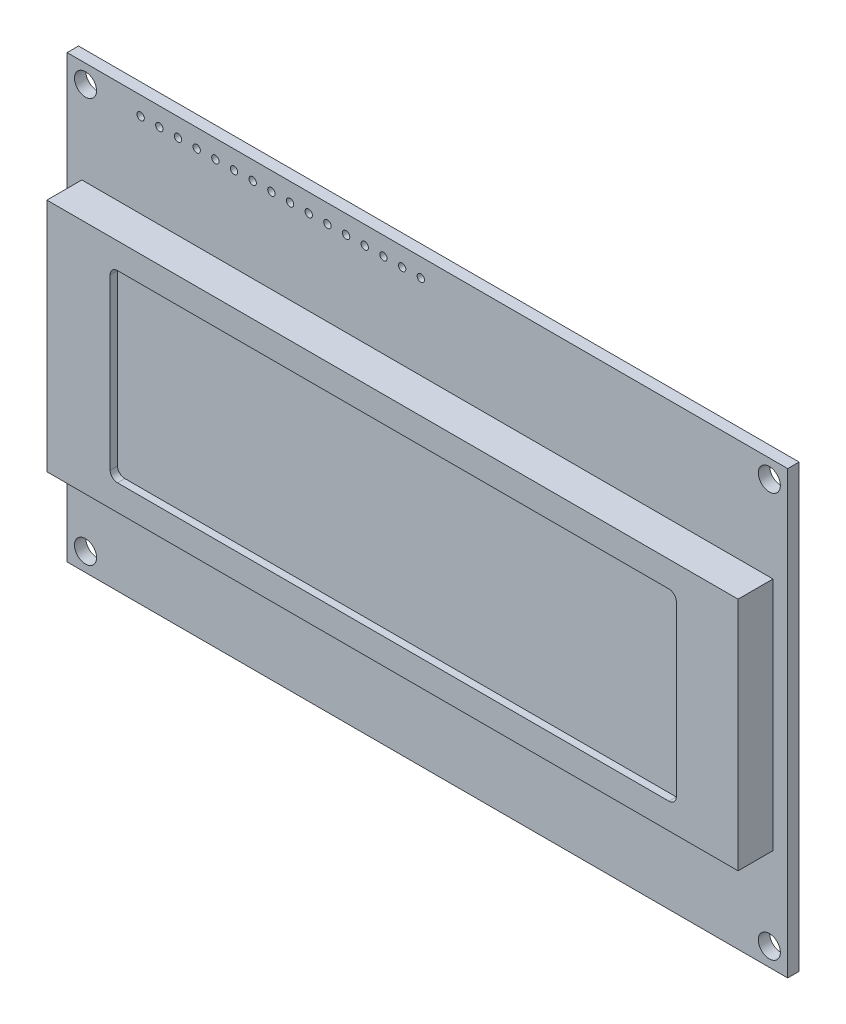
SolidWorks part; units mm, degrees
ref_plane "Plan de face" through (0, 0, 0) normal (0, 0, 1) x (1, 0, 0)
ref_plane "Plan de dessus" through (0, 0, 0) normal (0, 1, 0) x (1, 0, 0)
ref_plane "Plan de droite" through (0, 0, 0) normal (1, 0, 0) x (0, 0, -1)
sketch "Esquisse1" plane through (0, 0, 0) normal (0, 0, 1) x (1, 0, 0)
  line L0 (-72.6872, 29.4905) -> (26.4884, 29.4905) construction
  line L1 (-62.9008, 31.9905) -> (35.0992, 31.9905)
  line L2 (-62.9008, 31.9905) -> (-62.9008, -28.0095)
  line L3 (-62.9008, -28.0095) -> (35.0992, -28.0095)
  line L4 (35.0992, 31.9905) -> (35.0992, -28.0095)
  line L5 (-13.9008, 37.9919) -> (-13.9008, 16.1056) construction
  line L6 (-66.2376, 1.9905) -> (-49.9551, 1.9905) construction
  line L7 (-60.4008, 37.9919) -> (-60.4008, 24.6698) construction
  line L8 (-52.9008, 37.9919) -> (-52.9008, 24.6698) construction
  circle A0 centre (-60.4008, 29.4905) radius 1.5
  circle A1 centre (32.5992, 29.4905) radius 1.5
  circle A2 centre (32.5992, -25.5095) radius 1.5
  circle A3 centre (-60.4008, -25.5095) radius 1.5
  circle A4 centre (-52.9008, 29.4905) radius 0.5
  circle A5 centre (-50.3608, 29.4905) radius 0.5
  circle A6 centre (-47.8208, 29.4905) radius 0.5
  circle A7 centre (-45.2808, 29.4905) radius 0.5
  circle A8 centre (-42.7408, 29.4905) radius 0.5
  circle A9 centre (-40.2008, 29.4905) radius 0.5
  circle A10 centre (-37.6608, 29.4905) radius 0.5
  circle A11 centre (-35.1208, 29.4905) radius 0.5
  circle A12 centre (-32.5808, 29.4905) radius 0.5
  circle A13 centre (-30.0408, 29.4905) radius 0.5
  circle A14 centre (-27.5008, 29.4905) radius 0.5
  circle A15 centre (-24.9608, 29.4905) radius 0.5
  circle A16 centre (-22.4208, 29.4905) radius 0.5
  circle A17 centre (-19.8808, 29.4905) radius 0.5
  circle A18 centre (-17.3408, 29.4905) radius 0.5
  circle A19 centre (-14.8008, 29.4905) radius 0.5
  dimension "D5" = 7.5
  dimension "D6" = 16
  dimension "D1" = 98
  dimension "D2" = 60
  dimension "D3" = 2.5
  dimension "D4" = 2.5
extrude "Boss.-Extru.1" add sketch "Esquisse1" along normal blind 1.55
sketch "Esquisse2" plane through (0, 0, 1.55) normal (0, 0, 1) x (1, 0, 0)
  line L0 (-62.9008, 31.9905) -> (-62.9008, -28.0095) construction
  line L1 (-60.9008, 17.9905) -> (33.0992, 17.9905)
  line L2 (-60.9008, 17.9905) -> (-60.9008, -14.0095)
  line L3 (-60.9008, -14.0095) -> (33.0992, -14.0095)
  line L4 (33.0992, 17.9905) -> (33.0992, -14.0095)
  line L5 (-62.9008, -28.0095) -> (35.0992, -28.0095) construction
  dimension "D1" = 94
  dimension "D2" = 32
  dimension "D3" = 2
  dimension "D4" = 14
extrude "Boss.-Extru.2" add sketch "Esquisse2" along normal blind 4.75
sketch "Esquisse5" plane through (0, 0, 6.3) normal (0, 0, 1) x (1, 0, 0)
  line L0 (-60.9008, 17.9905) -> (-60.9008, -14.0095) construction
  line L1 (-51.3008, 14.4905) -> (23.6992, 14.4905)
  line L2 (-52.3008, 13.4905) -> (-52.3008, -9.5095)
  line L3 (-51.3008, -10.5095) -> (23.6992, -10.5095)
  line L4 (24.6992, 13.4905) -> (24.6992, -9.5095)
  line L5 (-60.9008, -14.0095) -> (33.0992, -14.0095) construction
  arc A0 (23.6992, -10.5095) -> (24.6992, -9.5095) centre (23.6992, -9.5095) ccw
  arc A1 (23.6992, 14.4905) -> (24.6992, 13.4905) centre (23.6992, 13.4905) cw
  arc A2 (-51.3008, 14.4905) -> (-52.3008, 13.4905) centre (-51.3008, 13.4905) ccw
  arc A3 (-52.3008, -9.5095) -> (-51.3008, -10.5095) centre (-51.3008, -9.5095) ccw
  point P14 (-52.3008, 14.4905)
  point P17 (-52.3008, -10.5095)
  dimension "D5" = 1
  dimension "D1" = 8.6
  dimension "D2" = 3.5
  dimension "D3" = 25
  dimension "D4" = 77
extrude "Enlèv. mat.-Extru.2" cut sketch "Esquisse5" against normal blind 1
